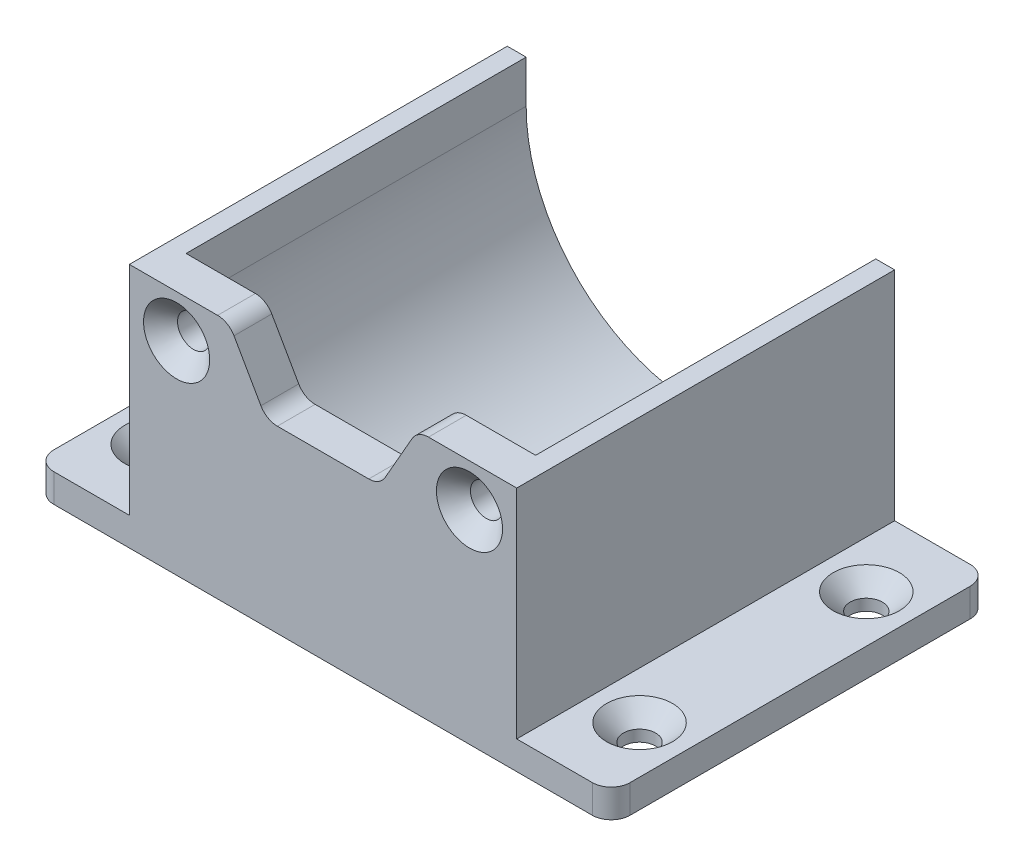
SolidWorks part; units mm, degrees
ref_plane "Piano frontale" through (0, 0, 0) normal (0, 0, 1) x (1, 0, 0)
ref_plane "Piano superiore" through (0, 0, 0) normal (0, 1, 0) x (1, 0, 0)
ref_plane "Piano destro" through (0, 0, 0) normal (1, 0, 0) x (0, 0, -1)
sketch "Schizzo1" plane through (0, 0, 0) normal (0, 0, 1) x (1, 0, 0)
  line L0 (0, -23.6499) -> (0, 44.5821) construction
  line L1 (-20.5, 13) -> (20.5, 13)
  line L2 (-20.5, 13) -> (-20.5, -13)
  line L3 (-20.5, -13) -> (20.5, -13)
  line L4 (20.5, 13) -> (20.5, -13)
  line L5 (-20.5, 13) -> (20.5, -13) construction
  line L6 (-20.5, -13) -> (20.5, 13) construction
  circle A0 centre (0, 8.5) radius 18.5 construction
  point P0 (0, 0)
  dimension "D3" = 37
  dimension "D1" = 41
  dimension "D2" = 26
  dimension "D4" = 21.5
extrude "Estrusione-Estrusione1" add sketch "Schizzo1" along normal blind 40
sketch "Schizzo2" plane through (0, 0, 0) normal (0, 0, -1) x (-1, 0, 0)
  circle A0 centre (0, 8.5) radius 18.5 construction
  circle A1 centre (0, 8.5) radius 18.5
extrude "Taglio-Estrusione1" cut sketch "Schizzo2" against normal blind 36
sketch "Schizzo3" plane through (0, 0, 40) normal (0, 0, 1) x (1, 0, 0)
  line L0 (-18.5, 8.5) -> (18.5, 8.5) construction
  line L1 (0, -23.6499) -> (0, 44.5821) construction
  line L2 (0, -23.6499) -> (0, 44.5821) construction
  circle A0 centre (0, 8.5) radius 18.5 construction
  circle A1 centre (-15.5, 8.5) radius 1.7
  circle A2 centre (0, 8.5) radius 18.5 construction
  circle A3 centre (15.5, 8.5) radius 1.7
  point P6 (0, 0)
  point P7 (-18.5, 8.5)
  point P8 (-18.5, 8.5)
  point P9 (18.5, 8.5)
  point P10 (17.6197, 14.1387)
  point P12 (-18.5, 8.5)
  dimension "D2" = 3.4
  dimension "D1" = 15.5
extrude "Taglio-Estrusione2" cut sketch "Schizzo3" against normal blind 36
chamfer "Smusso1" distance 1.8 angle 45 2 edges at (13.8, 8.5, 40) (-13.8, 8.5, 40)
sketch "Schizzo4" plane through (0, 0, 40) normal (0, 0, 1) x (1, 0, 0)
  line L0 (10, 13) -> (-10, 13)
  line L1 (-20.5, 13) -> (20.5, 13) construction
  line L2 (-10, 13) -> (-6, 6)
  line L3 (-6, 6) -> (6, 6)
  line L4 (0, -23.6499) -> (0, 44.5821) construction
  line L5 (0, 13) -> (0, -13) construction
  line L6 (-20.5, -13) -> (20.5, -13) construction
  line L7 (10, 13) -> (6, 6)
  point P12 (0, 6)
  dimension "D1" = 10
  dimension "D2" = 6
  dimension "D3" = 7
extrude "Taglio-Estrusione3" cut sketch "Schizzo4" against normal through all
fillet "Raccordo1" radius 2 4 edges at (6, 6, 38) (-6, 6, 38) (-10, 13, 38) (10, 13, 38)
sketch "Schizzo5" plane through (0, 0, 0) normal (0, 0, -1) x (-1, 0, 0)
  line L0 (-18.5, 8.5) -> (-18.5, 13)
  line L1 (20.5, 13) -> (-20.5, 13) construction
  line L2 (-18.5, 13) -> (-17.9444, 13)
  line L3 (0, 13) -> (0, 2.871) construction
  line L4 (0, -23.6499) -> (0, 44.5821) construction
  line L5 (18.5, 13) -> (17.9444, 13)
  line L6 (18.5, 8.5) -> (18.5, 13)
  circle A0 centre (0, 8.5) radius 18.5 construction
  arc A1 (-17.9444, 13) -> (-18.5, 8.5) centre (0, 8.5) ccw
  arc A2 (17.9444, 13) -> (18.5, 8.5) centre (0, 8.5) cw
extrude "Taglio-Estrusione4" cut sketch "Schizzo5" against normal blind 36
sketch "Schizzo6" plane through (0, -13, 0) normal (0, -1, 0) x (1, 0, 0)
  line L0 (-20.5, 0) -> (20.5, 0) construction
  line L1 (-20.5, 40) -> (-30.5, 40)
  line L2 (-20.5, 40) -> (-20.5, 0)
  line L3 (-20.5, 0) -> (-30.5, 0)
  line L4 (-30.5, 40) -> (-30.5, 0)
  line L5 (0, 40) -> (0, 0) construction
  line L6 (-20.5, 40) -> (20.5, 40) construction
  line L7 (-20.5, 0) -> (20.5, 0) construction
  line L8 (30.5, 40) -> (30.5, 0)
  line L9 (20.5, 0) -> (30.5, 0)
  line L10 (20.5, 40) -> (20.5, 0)
  line L11 (20.5, 40) -> (30.5, 40)
  dimension "D1" = 10
extrude "Estrusione-Estrusione2" add sketch "Schizzo6" against normal blind 3
fillet "Raccordo2" radius 2 4 edges at (30.5, -11.5, 0) (30.5, -11.5, 40) (-30.5, -11.5, 0) (-30.5, -11.5, 40)
sketch "Schizzo7" plane through (0, -10, 0) normal (0, 1, 0) x (1, 0, 0)
  line L0 (-25.5, 0) -> (-25.5, -40) construction
  line L1 (-20.5, -40) -> (-28.5, -40) construction
  line L2 (-20.5, -40) -> (-20.5, 0) construction
  line L3 (0, 0) -> (0, -40) construction
  line L4 (-4.8394, -40) -> (4.8394, -40) construction
  line L5 (-28.5, 0) -> (-20.5, 0) construction
  line L6 (-20.5, -20) -> (-30.5, -20) construction
  line L7 (-30.5, -38) -> (-30.5, -2) construction
  line L8 (20.5, -20) -> (30.5, -20) construction
  line L9 (25.5, 0) -> (25.5, -40) construction
  circle A0 centre (-25.5, -8) radius 1.7
  circle A1 centre (-25.5, -32) radius 1.7
  circle A2 centre (25.5, -32) radius 1.7
  circle A3 centre (25.5, -8) radius 1.7
  dimension "D2" = 3.4
  dimension "D1" = 5
  dimension "D3" = 8
extrude "Taglio-Estrusione5" cut sketch "Schizzo7" against normal through all
chamfer "Smusso2" distance 1.8 angle 45 4 edges at (25.5, -10, 6.3) (25.5, -10, 33.7) (-25.5, -10, 30.3) (-25.5, -10, 9.7)
